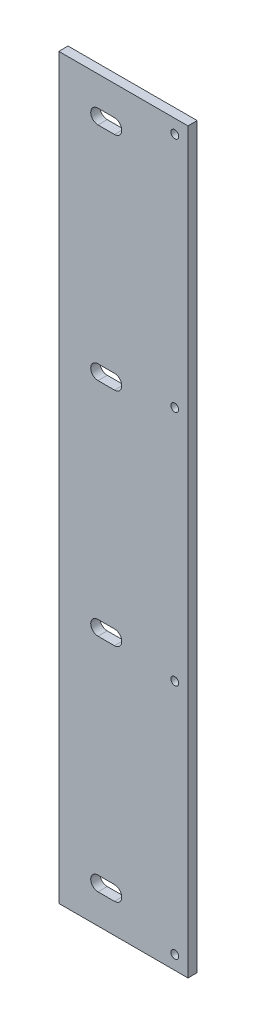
SolidWorks part; units mm, degrees
ref_plane "Front Plane" through (0, 0, 0) normal (0, 0, 1) x (1, 0, 0)
ref_plane "Top Plane" through (0, 0, 0) normal (0, 1, 0) x (1, 0, 0)
ref_plane "Right Plane" through (0, 0, 0) normal (1, 0, 0) x (0, 0, -1)
sketch "Sketch1" plane through (0, 0, 0) normal (0, 0, 1) x (1, 0, 0)
  line L1 (-14.9893, 183.5254) -> (29.4607, 183.5254)
  line L2 (-14.9893, 183.5254) -> (-14.9893, -70.4746)
  line L3 (-14.9893, -70.4746) -> (29.4607, -70.4746)
  line L4 (29.4607, 183.5254) -> (29.4607, -70.4746)
  dimension "D1" = 254
  dimension "D2" = 44.45
extrude "Boss-Extrude1" add sketch "Sketch1" along normal blind 3.175
hole_wizard "#6-32 Tapped Hole1" positions "Sketch3" profile "Sketch2" tap size "#6-32" standard "Ansi Inch"
sketch "Sketch3" plane through (0, 0, 3.175) normal (0, 0, 1) x (1, 0, 0)
  line L1 (29.4607, -70.4746) -> (29.4607, 183.5254) construction
  line L2 (29.4607, 183.5254) -> (-14.9893, 183.5254) construction
  point P2 (24.9243, 178.7756)
  point P5 (24.9243, 97.2924)
  point P8 (24.9243, 15.7584)
  point P11 (24.9243, -65.7248)
  dimension "D1" = 4.5364
  dimension "D2" = 81.534
  dimension "D3" = 81.4832
  dimension "D4" = 81.4832
  dimension "D5" = 4.7498
sketch "Sketch2" plane through (24.9243, 178.7756, 3.175) normal (1, 0, 0) x (0, -1, 0)
  line L0 (0, 0) -> (0, 3.175)
  line L1 (0, 3.175) -> (1.3525, 3.175)
  line L2 (1.3525, 3.175) -> (1.3525, 0)
  line L5 (1.3525, 0) -> (0, 0)
  line L11 (0, -6.35) -> (0, 107.95) construction
  dimension "Thread Major Dia." = 2.7051
  dimension "Thru Tap Drill Depth" = 3.175
sketch "Sketch5" plane through (0, 0, 3.175) normal (0, 0, 1) x (1, 0, 0)
  line L0 (-1.5078, 170.8254) -> (4.1722, 170.8254) construction
  line L1 (-1.5078, 173.3254) -> (4.1722, 173.3254)
  line L2 (-1.5078, 168.3254) -> (4.1722, 168.3254)
  line L3 (-1.5078, 183.5254) -> (-1.5078, -121.2746) construction
  line L4 (-14.9893, 183.5254) -> (-14.9893, -70.4746)
  line L5 (-14.9893, -70.4746) -> (29.4607, -70.4746)
  line L6 (29.4607, -70.4746) -> (29.4607, 183.5254)
  line L7 (29.4607, 183.5254) -> (-14.9893, 183.5254)
  line L8 (-14.9893, 183.5254) -> (-14.9893, -70.4746)
  line L9 (-14.9893, -70.4746) -> (29.4607, -70.4746)
  line L10 (29.4607, -70.4746) -> (29.4607, 183.5254)
  line L11 (29.4607, 183.5254) -> (-14.9893, 183.5254)
  line L12 (4.1722, 183.5254) -> (4.1722, -121.2746) construction
  line L13 (-1.5078, 183.5254) -> (-1.5078, -121.2746) construction
  line L14 (4.1722, 183.5254) -> (4.1722, -121.2746) construction
  line L15 (-1.5078, 181.9923) -> (4.1722, 181.9923) construction
  line L16 (1.3322, 181.9923) -> (1.3322, -70.4746) construction
  line L17 (-1.5078, 94.6254) -> (4.1722, 94.6254) construction
  line L18 (-1.5078, 97.1254) -> (4.1722, 97.1254)
  line L19 (-1.5078, 92.1254) -> (4.1722, 92.1254)
  line L20 (-1.5078, 18.4254) -> (4.1722, 18.4254) construction
  line L21 (-1.5078, 20.9254) -> (4.1722, 20.9254)
  line L22 (-1.5078, 15.9254) -> (4.1722, 15.9254)
  line L23 (-1.5078, -57.7746) -> (4.1722, -57.7746) construction
  line L24 (-1.5078, -55.2746) -> (4.1722, -55.2746)
  line L25 (-1.5078, -60.2746) -> (4.1722, -60.2746)
  arc A0 (-1.5078, 173.3254) -> (-1.5078, 168.3254) centre (-1.5078, 170.8254) ccw
  arc A1 (4.1722, 168.3254) -> (4.1722, 173.3254) centre (4.1722, 170.8254) ccw
  arc A2 (-1.5078, 97.1254) -> (-1.5078, 92.1254) centre (-1.5078, 94.6254) ccw
  arc A3 (4.1722, 92.1254) -> (4.1722, 97.1254) centre (4.1722, 94.6254) ccw
  arc A4 (-1.5078, 20.9254) -> (-1.5078, 15.9254) centre (-1.5078, 18.4254) ccw
  arc A5 (4.1722, 15.9254) -> (4.1722, 20.9254) centre (4.1722, 18.4254) ccw
  arc A6 (-1.5078, -55.2746) -> (-1.5078, -60.2746) centre (-1.5078, -57.7746) ccw
  arc A7 (4.1722, -60.2746) -> (4.1722, -55.2746) centre (4.1722, -57.7746) ccw
  point P6 (1.3322, 170.8254)
  point P21 (1.3322, 94.6254)
  point P26 (1.3322, 18.4254)
  point P35 (1.3322, -57.7746)
  dimension "D2" = 76.2
  dimension "Slot Width" = 5
  dimension "D3" = 12.7
  dimension "D4" = 76.2
  dimension "D5" = 76.2
  dimension "D1" = 0
extrude "Cut-Extrude1" cut sketch "Sketch5" against normal through all flip side to cut
